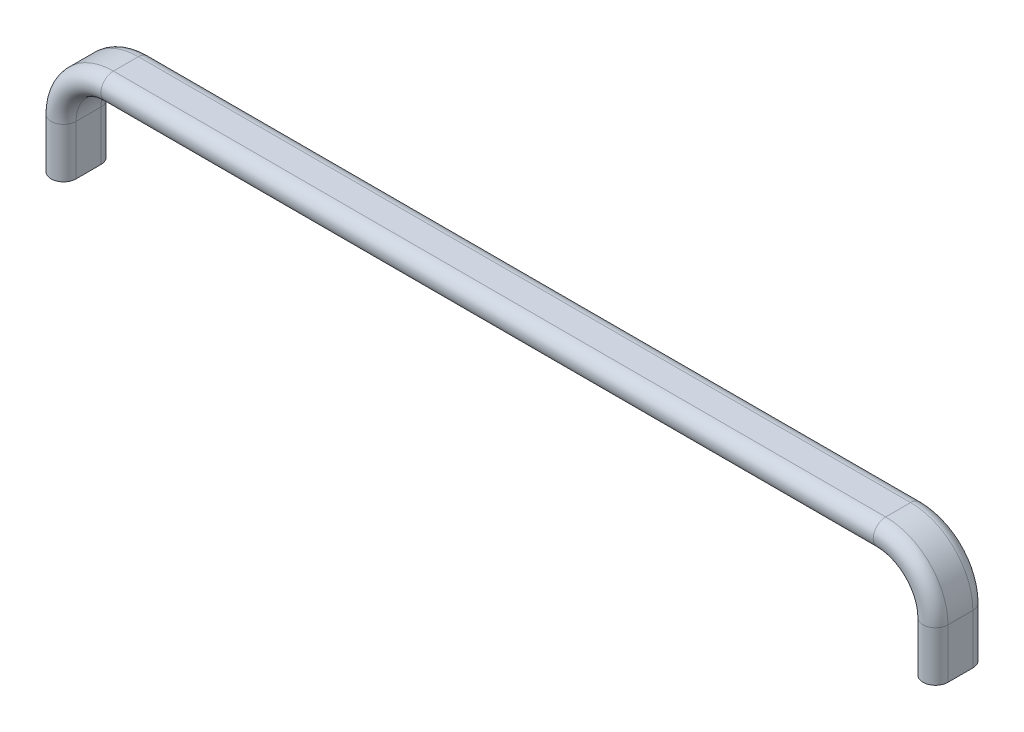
SolidWorks part; units mm, degrees
ref_plane "Front Plane" through (0, 0, 0) normal (0, 0, 1) x (1, 0, 0)
ref_plane "Top Plane" through (0, 0, 0) normal (0, 1, 0) x (1, 0, 0)
ref_plane "Right Plane" through (0, 0, 0) normal (1, 0, 0) x (0, 0, -1)
sketch "Sketch1" plane through (0, 0, 0) normal (0, 0, 1) x (1, 0, 0)
  line L0 (-175, 0) -> (-175, 20)
  line L1 (-155, 40) -> (155, 40)
  line L2 (0, 0) -> (0, 50000) construction
  line L3 (175, 0) -> (175, 20)
  arc A0 (-175, 20) -> (-155, 40) centre (-155, 20) cw
  arc A1 (175, 20) -> (155, 40) centre (155, 20) ccw
  point P9 (0, 40)
  dimension "D3" = 20
  dimension "D1" = 350
  dimension "D2" = 40
sketch "Sketch2" plane through (0, 0, 0) normal (0, 1, 0) x (1, 0, 0)
  line L0 (-180, -5) -> (-180, 5)
  line L1 (-170, 5) -> (-170, -5)
  line L2 (0, 0) -> (-50000, 0) construction
  line L3 (-175, -10) -> (-175, 10) construction
  arc A0 (-180, 5) -> (-170, 5) centre (-175, 5) cw
  arc A1 (-180, -5) -> (-170, -5) centre (-175, -5) ccw
  point P0 (-175, 10)
  point P6 (-180, 0)
  point P10 (-170, 0)
  point P11 (-175, -10)
  point P15 (-175, 0)
  dimension "D1" = 10
  dimension "D2" = 20
sweep "Sweep1" add profiles "Sketch2" path "Sketch1"
sketch "Sketch3" plane through (0, 0, 0) normal (0, -1, 0) x (1, 0, 0)
  circle A0 centre (-175, 0) radius 2.1
  dimension "D1" = 4.2
  dimension "D2" = 175
extrude "Extrude1" cut sketch "Sketch3" against normal blind 12.5
sketch "Sketch4" plane through (0, 0, 0) normal (0, -1, 0) x (1, 0, 0)
  circle A0 centre (-175, 0) radius 2.5
  dimension "D1" = 5
extrude "Extrude2" cut sketch "Sketch4" against normal blind 10
sketch "Sketch5" plane through (0, 0, 0) normal (0, 0, 1) x (1, 0, 0)
  line L0 (-175, 12.5) -> (-177.1, 12.5)
  line L1 (-177.1, 12.5) -> (-175, 13.7124)
  line L2 (-175, 13.7124) -> (-175, 12.5)
  dimension "D1" = 30
  dimension "D2" = 2.1
  dimension "D3" = 12.5
  dimension "D4" = 175
revolve "Cut-Revolve1" cut sketch "Sketch5" angle 360 about L2
mirror "Mirror1" about plane through (0, 0, 0) normal (1, 0, 0) of "Cut-Revolve1", "Extrude2", "Extrude1"
equation "\"D2@Sketch3\" = \"D1@Sketch1\"/2"
equation "\"D2@Sketch5\" = \"D1@Sketch3\"/2"
equation "\"D3@Sketch5\" = \"D1@Extrude1\""
equation "\"D4@Sketch5\" = \"D1@Sketch1\"/2"
